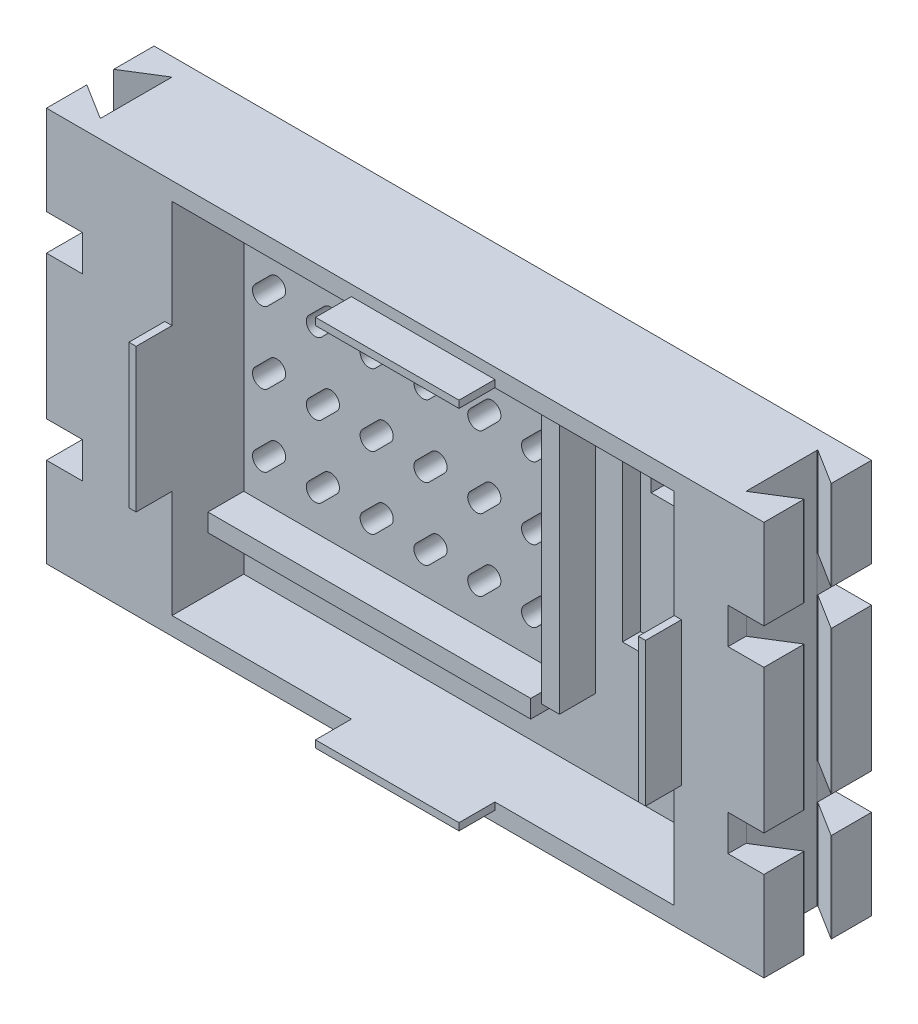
SolidWorks part; units mm, degrees
ref_plane "Front Plane" through (0, 0, 0) normal (0, 0, 1) x (1, 0, 0)
ref_plane "Top Plane" through (0, 0, 0) normal (0, 1, 0) x (1, 0, 0)
ref_plane "Right Plane" through (0, 0, 0) normal (1, 0, 0) x (0, 0, -1)
sketch "Sketch1" plane through (0, 0, 0) normal (0, 0, 1) x (1, 0, 0)
  line L1 (0, 0) -> (150, 0)
  line L2 (0, 0) -> (0, -110)
  line L3 (0, -110) -> (150, -110)
  line L4 (150, 0) -> (150, -110)
  dimension "D1" = 150
  dimension "D2" = 110
extrude "Boss-Extrude1" add sketch "Sketch1" along normal blind 30
sketch "Sketch2" plane through (0, 0, 30) normal (0, 0, 1) x (1, 0, 0)
  line L14 (5, -105) -> (145, -105)
  line L15 (145, -105) -> (145, -5)
  line L16 (5, -5) -> (5, -105)
  line L17 (145, -5) -> (5, -5)
  line L18 (5, -105) -> (145, -105)
  line L19 (145, -105) -> (145, -5)
  line L20 (5, -5) -> (5, -105)
  line L21 (145, -5) -> (5, -5)
  dimension "D1" = 5
extrude "Cut-Extrude1" cut sketch "Sketch2" against normal blind 20
sketch "Sketch3" plane through (0, 0, 10) normal (0, 0, 1) x (1, 0, 0)
  line L0 (5, -85) -> (95, -85)
  line L1 (5, -5) -> (5, -105) construction
  line L2 (145, -5) -> (5, -5) construction
  line L3 (95, -85) -> (95, -90)
  line L4 (95, -90) -> (5, -90)
  line L5 (5, -90) -> (5, -85)
  dimension "D1" = 90
  dimension "D2" = 80
  dimension "D3" = 5
extrude "Boss-Extrude3" add sketch "Sketch3" along normal blind 10
sketch "Sketch4" plane through (0, 0, 10) normal (0, 0, 1) x (1, 0, 0)
  line L0 (98, -84.8392) -> (98, -5)
  line L1 (95, -90) -> (95, -85) construction
  line L2 (145, -5) -> (5, -5) construction
  line L4 (98, -84.8392) -> (103, -84.8392)
  line L5 (103, -84.8392) -> (103, -5)
  line L6 (103, -5) -> (98, -5)
  dimension "D1" = 3
  dimension "D2" = 5
extrude "Boss-Extrude4" add sketch "Sketch4" along normal blind 10
sketch "Sketch5" plane through (0, 0, 10) normal (0, 0, 1) x (1, 0, 0)
  line L0 (9.93, -15.1693) -> (14.1727, -10.9266) construction
  line L1 (8.1623, -13.4015) -> (12.4049, -9.1589)
  line L2 (11.6978, -16.937) -> (15.9405, -12.6944)
  line L3 (24.93, -15.1693) -> (29.1727, -10.9266) construction
  line L4 (23.1623, -13.4015) -> (27.4049, -9.1589)
  line L5 (26.6978, -16.937) -> (30.9405, -12.6944)
  line L6 (39.93, -15.1693) -> (44.1727, -10.9266) construction
  line L7 (38.1623, -13.4015) -> (42.4049, -9.1589)
  line L8 (41.6978, -16.937) -> (45.9405, -12.6944)
  line L9 (54.93, -15.1693) -> (59.1727, -10.9266) construction
  line L10 (53.1623, -13.4015) -> (57.4049, -9.1589)
  line L11 (56.6978, -16.937) -> (60.9405, -12.6944)
  line L12 (69.93, -15.1693) -> (74.1727, -10.9266) construction
  line L13 (68.1623, -13.4015) -> (72.4049, -9.1589)
  line L14 (71.6978, -16.937) -> (75.9405, -12.6944)
  line L15 (84.93, -15.1693) -> (89.1727, -10.9266) construction
  line L16 (83.1623, -13.4015) -> (87.4049, -9.1589)
  line L17 (86.6978, -16.937) -> (90.9405, -12.6944)
  line L18 (24.93, -35.1693) -> (29.1727, -30.9266) construction
  line L19 (23.1623, -33.4015) -> (27.4049, -29.1589)
  line L20 (26.6978, -36.937) -> (30.9405, -32.6944)
  line L21 (39.93, -35.1693) -> (44.1727, -30.9266) construction
  line L22 (38.1623, -33.4015) -> (42.4049, -29.1589)
  line L23 (41.6978, -36.937) -> (45.9405, -32.6944)
  line L24 (54.93, -35.1693) -> (59.1727, -30.9266) construction
  line L25 (53.1623, -33.4015) -> (57.4049, -29.1589)
  line L26 (56.6978, -36.937) -> (60.9405, -32.6944)
  line L27 (69.93, -35.1693) -> (74.1727, -30.9266) construction
  line L28 (68.1623, -33.4015) -> (72.4049, -29.1589)
  line L29 (71.6978, -36.937) -> (75.9405, -32.6944)
  line L30 (84.93, -35.1693) -> (89.1727, -30.9266) construction
  line L31 (83.1623, -33.4015) -> (87.4049, -29.1589)
  line L32 (86.6978, -36.937) -> (90.9405, -32.6944)
  line L33 (24.93, -55.1693) -> (29.1727, -50.9266) construction
  line L34 (23.1623, -53.4015) -> (27.4049, -49.1589)
  line L35 (26.6978, -56.937) -> (30.9405, -52.6944)
  line L36 (39.93, -55.1693) -> (44.1727, -50.9266) construction
  line L37 (38.1623, -53.4015) -> (42.4049, -49.1589)
  line L38 (41.6978, -56.937) -> (45.9405, -52.6944)
  line L39 (54.93, -55.1693) -> (59.1727, -50.9266) construction
  line L40 (53.1623, -53.4015) -> (57.4049, -49.1589)
  line L41 (56.6978, -56.937) -> (60.9405, -52.6944)
  line L42 (69.93, -55.1693) -> (74.1727, -50.9266) construction
  line L43 (68.1623, -53.4015) -> (72.4049, -49.1589)
  line L44 (71.6978, -56.937) -> (75.9405, -52.6944)
  line L45 (84.93, -55.1693) -> (89.1727, -50.9266) construction
  line L46 (83.1623, -53.4015) -> (87.4049, -49.1589)
  line L47 (86.6978, -56.937) -> (90.9405, -52.6944)
  line L48 (24.93, -75.1693) -> (29.1727, -70.9266) construction
  line L49 (23.1623, -73.4015) -> (27.4049, -69.1589)
  line L50 (26.6978, -76.937) -> (30.9405, -72.6944)
  line L51 (39.93, -75.1693) -> (44.1727, -70.9266) construction
  line L52 (38.1623, -73.4015) -> (42.4049, -69.1589)
  line L53 (41.6978, -76.937) -> (45.9405, -72.6944)
  line L54 (54.93, -75.1693) -> (59.1727, -70.9266) construction
  line L55 (53.1623, -73.4015) -> (57.4049, -69.1589)
  line L56 (56.6978, -76.937) -> (60.9405, -72.6944)
  line L57 (69.93, -75.1693) -> (74.1727, -70.9266) construction
  line L58 (68.1623, -73.4015) -> (72.4049, -69.1589)
  line L59 (71.6978, -76.937) -> (75.9405, -72.6944)
  line L60 (84.93, -75.1693) -> (89.1727, -70.9266) construction
  line L61 (83.1623, -73.4015) -> (87.4049, -69.1589)
  line L62 (86.6978, -76.937) -> (90.9405, -72.6944)
  line L63 (9.93, -35.1693) -> (14.1727, -30.9266) construction
  line L64 (8.1623, -33.4015) -> (12.4049, -29.1589)
  line L65 (11.6978, -36.937) -> (15.9405, -32.6944)
  line L66 (9.93, -55.1693) -> (14.1727, -50.9266) construction
  line L67 (8.1623, -53.4015) -> (12.4049, -49.1589)
  line L68 (11.6978, -56.937) -> (15.9405, -52.6944)
  line L69 (9.93, -75.1693) -> (14.1727, -70.9266) construction
  line L70 (8.1623, -73.4015) -> (12.4049, -69.1589)
  line L71 (11.6978, -76.937) -> (15.9405, -72.6944)
  arc A0 (8.1623, -13.4015) -> (11.6978, -16.937) centre (9.93, -15.1693) ccw
  arc A1 (15.9405, -12.6944) -> (12.4049, -9.1589) centre (14.1727, -10.9266) ccw
  arc A2 (23.1623, -13.4015) -> (26.6978, -16.937) centre (24.93, -15.1693) ccw
  arc A3 (30.9405, -12.6944) -> (27.4049, -9.1589) centre (29.1727, -10.9266) ccw
  arc A4 (38.1623, -13.4015) -> (41.6978, -16.937) centre (39.93, -15.1693) ccw
  arc A5 (45.9405, -12.6944) -> (42.4049, -9.1589) centre (44.1727, -10.9266) ccw
  arc A6 (53.1623, -13.4015) -> (56.6978, -16.937) centre (54.93, -15.1693) ccw
  arc A7 (60.9405, -12.6944) -> (57.4049, -9.1589) centre (59.1727, -10.9266) ccw
  arc A8 (68.1623, -13.4015) -> (71.6978, -16.937) centre (69.93, -15.1693) ccw
  arc A9 (75.9405, -12.6944) -> (72.4049, -9.1589) centre (74.1727, -10.9266) ccw
  arc A10 (83.1623, -13.4015) -> (86.6978, -16.937) centre (84.93, -15.1693) ccw
  arc A11 (90.9405, -12.6944) -> (87.4049, -9.1589) centre (89.1727, -10.9266) ccw
  arc A12 (23.1623, -33.4015) -> (26.6978, -36.937) centre (24.93, -35.1693) ccw
  arc A13 (30.9405, -32.6944) -> (27.4049, -29.1589) centre (29.1727, -30.9266) ccw
  arc A14 (38.1623, -33.4015) -> (41.6978, -36.937) centre (39.93, -35.1693) ccw
  arc A15 (45.9405, -32.6944) -> (42.4049, -29.1589) centre (44.1727, -30.9266) ccw
  arc A16 (53.1623, -33.4015) -> (56.6978, -36.937) centre (54.93, -35.1693) ccw
  arc A17 (60.9405, -32.6944) -> (57.4049, -29.1589) centre (59.1727, -30.9266) ccw
  arc A18 (68.1623, -33.4015) -> (71.6978, -36.937) centre (69.93, -35.1693) ccw
  arc A19 (75.9405, -32.6944) -> (72.4049, -29.1589) centre (74.1727, -30.9266) ccw
  arc A20 (83.1623, -33.4015) -> (86.6978, -36.937) centre (84.93, -35.1693) ccw
  arc A21 (90.9405, -32.6944) -> (87.4049, -29.1589) centre (89.1727, -30.9266) ccw
  arc A22 (23.1623, -53.4015) -> (26.6978, -56.937) centre (24.93, -55.1693) ccw
  arc A23 (30.9405, -52.6944) -> (27.4049, -49.1589) centre (29.1727, -50.9266) ccw
  arc A24 (38.1623, -53.4015) -> (41.6978, -56.937) centre (39.93, -55.1693) ccw
  arc A25 (45.9405, -52.6944) -> (42.4049, -49.1589) centre (44.1727, -50.9266) ccw
  arc A26 (53.1623, -53.4015) -> (56.6978, -56.937) centre (54.93, -55.1693) ccw
  arc A27 (60.9405, -52.6944) -> (57.4049, -49.1589) centre (59.1727, -50.9266) ccw
  arc A28 (68.1623, -53.4015) -> (71.6978, -56.937) centre (69.93, -55.1693) ccw
  arc A29 (75.9405, -52.6944) -> (72.4049, -49.1589) centre (74.1727, -50.9266) ccw
  arc A30 (83.1623, -53.4015) -> (86.6978, -56.937) centre (84.93, -55.1693) ccw
  arc A31 (90.9405, -52.6944) -> (87.4049, -49.1589) centre (89.1727, -50.9266) ccw
  arc A32 (23.1623, -73.4015) -> (26.6978, -76.937) centre (24.93, -75.1693) ccw
  arc A33 (30.9405, -72.6944) -> (27.4049, -69.1589) centre (29.1727, -70.9266) ccw
  arc A34 (38.1623, -73.4015) -> (41.6978, -76.937) centre (39.93, -75.1693) ccw
  arc A35 (45.9405, -72.6944) -> (42.4049, -69.1589) centre (44.1727, -70.9266) ccw
  arc A36 (53.1623, -73.4015) -> (56.6978, -76.937) centre (54.93, -75.1693) ccw
  arc A37 (60.9405, -72.6944) -> (57.4049, -69.1589) centre (59.1727, -70.9266) ccw
  arc A38 (68.1623, -73.4015) -> (71.6978, -76.937) centre (69.93, -75.1693) ccw
  arc A39 (75.9405, -72.6944) -> (72.4049, -69.1589) centre (74.1727, -70.9266) ccw
  arc A40 (83.1623, -73.4015) -> (86.6978, -76.937) centre (84.93, -75.1693) ccw
  arc A41 (90.9405, -72.6944) -> (87.4049, -69.1589) centre (89.1727, -70.9266) ccw
  arc A42 (8.1623, -33.4015) -> (11.6978, -36.937) centre (9.93, -35.1693) ccw
  arc A43 (15.9405, -32.6944) -> (12.4049, -29.1589) centre (14.1727, -30.9266) ccw
  arc A44 (8.1623, -53.4015) -> (11.6978, -56.937) centre (9.93, -55.1693) ccw
  arc A45 (15.9405, -52.6944) -> (12.4049, -49.1589) centre (14.1727, -50.9266) ccw
  arc A46 (8.1623, -73.4015) -> (11.6978, -76.937) centre (9.93, -75.1693) ccw
  arc A47 (15.9405, -72.6944) -> (12.4049, -69.1589) centre (14.1727, -70.9266) ccw
  point P2 (12.0514, -13.048)
  point P12 (27.0514, -13.048)
  point P19 (42.0514, -13.048)
  point P26 (57.0514, -13.048)
  point P33 (72.0514, -13.048)
  point P40 (87.0514, -13.048)
  point P47 (27.0514, -33.048)
  point P54 (42.0514, -33.048)
  point P61 (57.0514, -33.048)
  point P68 (72.0514, -33.048)
  point P75 (87.0514, -33.048)
  point P82 (27.0514, -53.048)
  point P89 (42.0514, -53.048)
  point P96 (57.0514, -53.048)
  point P103 (72.0514, -53.048)
  point P110 (87.0514, -53.048)
  point P117 (27.0514, -73.048)
  point P124 (42.0514, -73.048)
  point P131 (57.0514, -73.048)
  point P138 (72.0514, -73.048)
  point P145 (87.0514, -73.048)
  point P152 (12.0514, -33.048)
  point P159 (12.0514, -53.048)
  point P166 (12.0514, -73.048)
  dimension "D1" = 6
  dimension "D2" = 4
extrude "Cut-Extrude3" cut sketch "Sketch5" against normal blind 30
sketch "Sketch6" plane through (150, 0, 0) normal (1, 0, 0) x (0, 0, -1)
  line L0 (-30, 0) -> (0, 0)
  line L1 (0, 0) -> (0, -110)
  line L2 (0, -110) -> (-30, -110)
  line L3 (-30, -110) -> (-30, 0)
extrude "Boss-Extrude5" add sketch "Sketch6" along normal blind 20
sketch "Sketch7" plane through (0, -110, 0) normal (0, -1, 0) x (1, 0, 0)
  line L0 (170, 18.75) -> (159.9979, 25)
  line L2 (170, 0) -> (170, 5.4479) construction
  line L4 (170, 5.4479) -> (170, 17.0521) construction
  line L5 (170, 17.0521) -> (170, 20.4479) construction
  line L6 (170, 18.75) -> (170, 11.25)
  line L7 (159.9979, 25) -> (159.9979, 5)
  line L8 (159.9979, 5) -> (170, 11.25)
  line L9 (0, 0) -> (170, 0) construction
  dimension "D1" = 58
  dimension "D2" = 58
  dimension "D3" = 7.5
  dimension "D4" = 5
  dimension "D5" = 20
extrude "Cut-Extrude4" cut sketch "Sketch7" against normal blind 160
sketch "Sketch8" plane through (0, 0, 0) normal (-1, 0, 0) x (0, 0, 1)
  line L0 (30, 0) -> (0, 0)
  line L1 (0, 0) -> (0, -110)
  line L2 (0, -110) -> (30, -110)
  line L3 (30, -110) -> (30, 0)
extrude "Boss-Extrude6" add sketch "Sketch8" along normal blind 30
sketch "Sketch9" plane through (0, -110, 0) normal (0, -1, 0) x (1, 0, 0)
  line L0 (-30, 0) -> (-30, 30) construction
  line L1 (-30, 30) -> (-30, 15) construction
  line L2 (-30, 15) -> (-30, 22.5) construction
  line L3 (-30, 0) -> (-30, 15) construction
  line L4 (-30, 15) -> (-30, 7.5) construction
  line L5 (-30, 11.25) -> (-30, 18.75)
  line L6 (-30, 18.75) -> (-19.9979, 25)
  line L7 (-19.9979, 25) -> (-19.9979, 5)
  line L8 (-19.9979, 5) -> (-30, 11.25)
  line L9 (-30, 30) -> (170, 30) construction
  dimension "D1" = 20
  dimension "D2" = 5
  dimension "D3" = 58
  dimension "D4" = 58
extrude "Cut-Extrude5" cut sketch "Sketch9" against normal blind 120
fillet "Fillet5" radius 0.1 1 edges at (-19.9979, -55, 5)
fillet "Fillet6" radius 0.1 1 edges at (-19.9979, -55, 25)
fillet "Fillet7" radius 0.1 2 edges at (159.9979, -55, 25) (159.9979, -55, 5)
fillet "Fillet8" radius 0.1 2 edges at (170, -55, 18.75) (170, -55, 11.25)
sketch "Sketch21" plane through (0, 0, 10) normal (0, 0, 1) x (1, 0, 0)
  line L1 (110.5586, -8.5837) -> (136.0586, -8.5837)
  line L2 (110.5586, -8.5837) -> (110.5586, -33.5837)
  line L3 (110.5586, -33.5837) -> (136.0586, -33.5837)
  line L4 (136.0586, -8.5837) -> (136.0586, -33.5837)
  dimension "D1" = 25.5
  dimension "D2" = 25
extrude "Cut-Extrude10" cut sketch "Sketch21" against normal blind 5 contours L2 L1 L4 L3
sketch "Sketch22" plane through (0, 0, 5) normal (0, 0, 1) x (1, 0, 0)
  line L0 (110.5586, -8.5837) -> (136.0586, -8.5837) construction
  line L1 (113.5586, -8.5837) -> (133.0586, -8.5837)
  line L2 (113.5586, -8.5837) -> (113.5586, -33.5837)
  line L3 (113.5586, -33.5837) -> (133.0586, -33.5837)
  line L4 (133.0586, -8.5837) -> (133.0586, -33.5837)
  line L5 (110.5586, -33.5837) -> (136.0586, -33.5837) construction
  dimension "D1" = 3
  dimension "D2" = 3
extrude "Cut-Extrude11" cut sketch "Sketch22" against normal blind 5
sketch "Sketch23" plane through (0, 0, 10) normal (0, 0, 1) x (1, 0, 0)
  line L0 (110.5586, -33.5837) -> (136.0586, -33.5837) construction
  line L1 (112.5586, -33.5837) -> (134.0586, -33.5837)
  line L2 (112.5586, -33.5837) -> (112.5586, -68.5837)
  line L3 (112.5586, -68.5837) -> (134.0586, -68.5837)
  line L4 (134.0586, -33.5837) -> (134.0586, -68.5837)
  dimension "D1" = 2
  dimension "D2" = 2
  dimension "D3" = 35
extrude "Cut-Extrude12" cut sketch "Sketch23" against normal blind 5
sketch "Sketch28" plane through (0, 0, 30) normal (0, 0, 1) x (1, 0, 0)
  line L0 (145, -5) -> (5, -5) construction
  line L1 (95, -5) -> (55, -5)
  line L2 (95, -5) -> (95, -3)
  line L3 (95, -3) -> (55, -3)
  line L4 (55, -5) -> (55, -3)
  line L5 (5, -105) -> (145, -105) construction
  line L6 (95, -105) -> (55, -105)
  line L7 (95, -105) -> (95, -107)
  line L8 (95, -107) -> (55, -107)
  line L9 (55, -105) -> (55, -107)
  dimension "D1" = 2
  dimension "D2" = 40
  dimension "D3" = 50
  dimension "D4" = 40
  dimension "D5" = 2
  dimension "D6" = 50
extrude "Boss-Extrude8" add sketch "Sketch28" along normal blind 10
sketch "Sketch29" plane through (0, 0, 30) normal (0, 0, 1) x (1, 0, 0)
  line L0 (5, -5) -> (5, -105) construction
  line L1 (5, -75) -> (3, -75)
  line L2 (5, -75) -> (5, -35)
  line L3 (5, -35) -> (3, -35)
  line L4 (3, -75) -> (3, -35)
  line L5 (145, -105) -> (145, -5) construction
  line L6 (145, -75) -> (147, -75)
  line L7 (145, -75) -> (145, -35)
  line L8 (145, -35) -> (147, -35)
  line L9 (147, -75) -> (147, -35)
  dimension "D1" = 2
  dimension "D2" = 40
  dimension "D3" = 30
  dimension "D4" = 40
  dimension "D5" = 2
  dimension "D6" = 30
extrude "Boss-Extrude9" add sketch "Sketch29" along normal blind 10
sketch "Sketch30" plane through (0, 0, 10) normal (0, 0, 1) x (1, 0, 0)
  line L0 (110.5586, -8.5837) -> (136.0586, -8.5837)
  line L1 (110.5586, -8.5837) -> (110.5586, -68.5837)
  line L2 (136.0586, -8.5837) -> (136.0586, -68.5837)
  line L3 (110.5586, -68.5837) -> (136.0586, -68.5837)
  dimension "D1" = 60
extrude "Cut-Extrude13" cut sketch "Sketch30" against normal blind 5
sketch "Sketch32" plane through (110.5586, 0, 0) normal (1, 0, 0) x (0, 0, -1)
  line L1 (-10, -8.5837) -> (-6.5, -8.5837)
  line L2 (-10, -8.5837) -> (-10, -12.5837)
  line L3 (-10, -12.5837) -> (-6.5, -12.5837)
  line L4 (-6.5, -8.5837) -> (-6.5, -12.5837)
  dimension "D1" = 3.5
  dimension "D2" = 4
extrude "Boss-Extrude10" add sketch "Sketch32" along normal blind 2.5
sketch "Sketch33" plane through (136.0586, 0, 0) normal (-1, 0, 0) x (0, 0, 1)
  line L1 (10, -8.5837) -> (6.5, -8.5837)
  line L2 (10, -8.5837) -> (10, -12.5837)
  line L3 (10, -12.5837) -> (6.5, -12.5837)
  line L4 (6.5, -8.5837) -> (6.5, -12.5837)
  dimension "D1" = 4
  dimension "D2" = 3.5
extrude "Boss-Extrude11" add sketch "Sketch33" along normal blind 2.5
sketch "Sketch34" plane through (0, 0, 30) normal (0, 0, 1) x (1, 0, 0)
  line L0 (-30, -110) -> (-30, 0) construction
  line L1 (-30, -85) -> (-20, -85)
  line L2 (-30, -85) -> (-30, -75)
  line L3 (-30, -75) -> (-20, -75)
  line L4 (-20, -85) -> (-20, -75)
  line L5 (-30, -110) -> (170, -110) construction
  line L6 (170, 0) -> (-30, 0) construction
  line L7 (-30, -25) -> (-20, -25)
  line L8 (-30, -25) -> (-30, -35)
  line L9 (-30, -35) -> (-20, -35)
  line L10 (-20, -25) -> (-20, -35)
  dimension "D1" = 10
  dimension "D2" = 10
  dimension "D3" = 25
  dimension "D4" = 10
  dimension "D5" = 10
  dimension "D6" = 25
extrude "Cut-Extrude14" cut sketch "Sketch34" against normal blind 42.5
sketch "Sketch35" plane through (0, 0, 30) normal (0, 0, 1) x (1, 0, 0)
  line L0 (170, 0) -> (170, -110) construction
  line L1 (170, -85) -> (160, -85)
  line L2 (170, -85) -> (170, -75)
  line L3 (170, -75) -> (160, -75)
  line L4 (160, -85) -> (160, -75)
  line L5 (-30, -110) -> (170, -110) construction
  line L6 (170, 0) -> (-30, 0) construction
  line L7 (170, -35) -> (160, -35)
  line L8 (170, -35) -> (170, -25)
  line L9 (170, -25) -> (160, -25)
  line L10 (160, -35) -> (160, -25)
  dimension "D1" = 10
  dimension "D2" = 25
  dimension "D3" = 10
  dimension "D4" = 25
  dimension "D5" = 10
  dimension "D6" = 10
extrude "Cut-Extrude15" cut sketch "Sketch35" against normal blind 42.5
